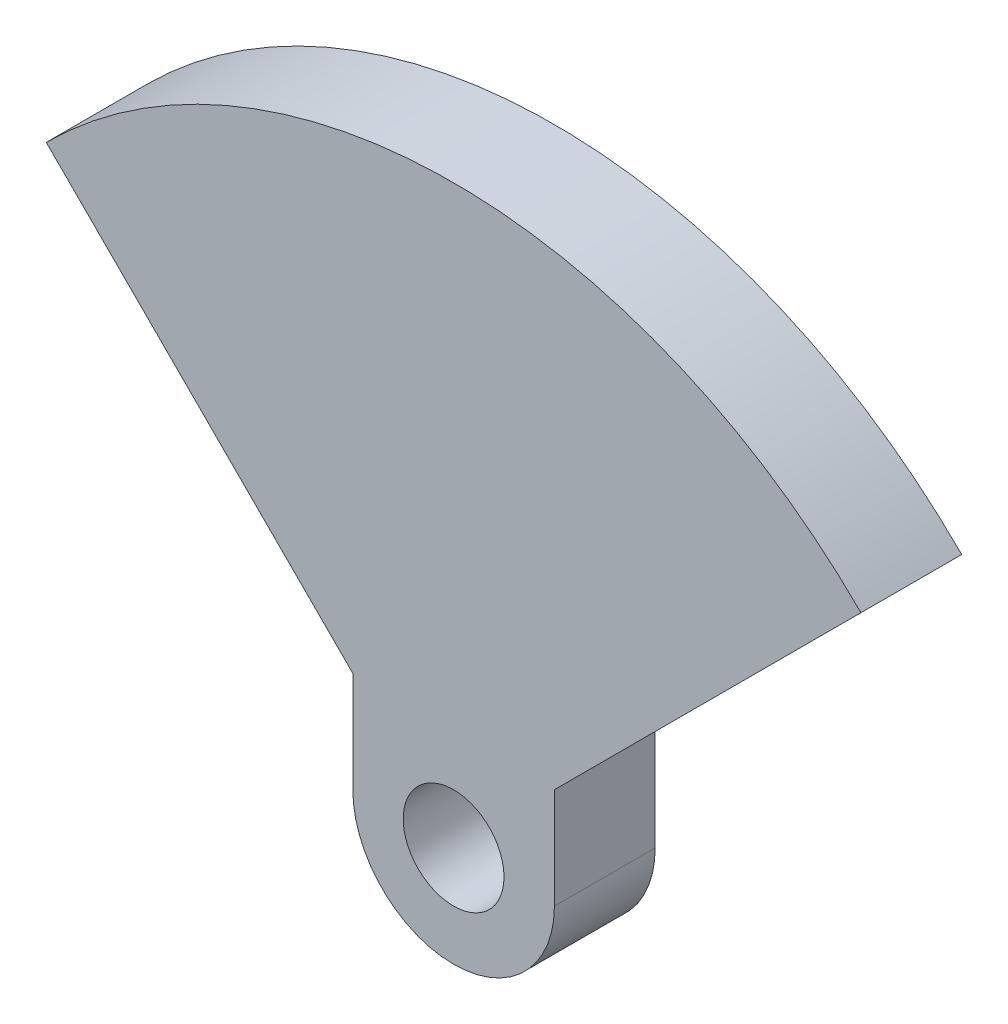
SolidWorks part; units mm, degrees
ref_plane "Front Plane" through (0, 0, 0) normal (0, 0, 1) x (1, 0, 0)
ref_plane "Top Plane" through (0, 0, 0) normal (0, 1, 0) x (1, 0, 0)
ref_plane "Right Plane" through (0, 0, 0) normal (1, 0, 0) x (0, 0, -1)
sketch "Sketch1" plane through (0, 0, 0) normal (0, 0, 1) x (1, 0, 0)
  line L0 (0, 0) -> (-2.1213, 2.1213)
  line L1 (0, 0) -> (2.1213, 2.1213)
  line L2 (-6, 0) -> (-6, 6)
  line L3 (6, 0) -> (6, 6)
  line L4 (-6, 6) -> (-24.2467, 24.2467)
  line L5 (6, 6) -> (24.2467, 24.2467)
  arc A0 (24.2467, 24.2467) -> (-24.2467, 24.2467) centre (0, 0) ccw
  circle A1 centre (0, 0) radius 3
  arc A2 (-6, 0) -> (6, 0) centre (0, 0) ccw
extrude "Boss-Extrude1" add sketch "Sketch1" along normal blind 6 contours L2 A2 L3 L5 A0 L4 A1
equation "\"length\"= 2.7"
equation "\"D1@Sketch1\"=\"length\""
equation "\"dowel thick\"= 6mm"
equation "\"D3@Sketch1\"=\"dowel thick\""
equation "\"D4@Sketch1\"=\"dowel thick\"*2"
equation "\"D1@Boss-Extrude1\"=6mm"
